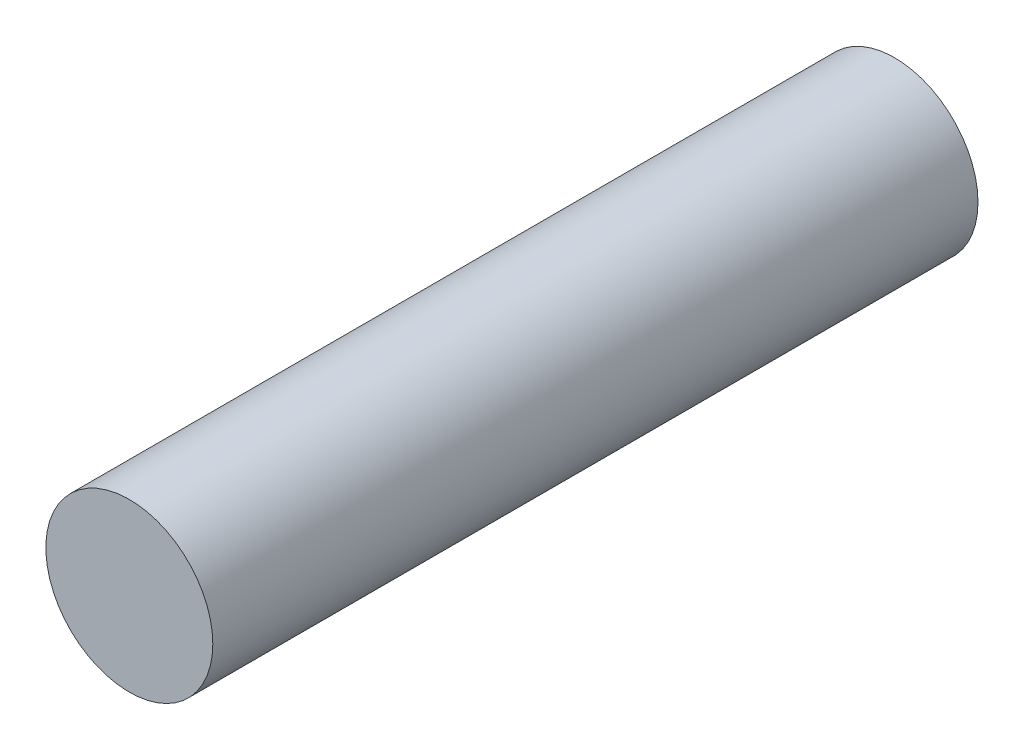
SolidWorks part; units mm, degrees
ref_plane "Płaszczyzna przednia" through (0, 0, 0) normal (0, 0, 1) x (1, 0, 0)
ref_plane "Płaszczyzna górna" through (0, 0, 0) normal (0, 1, 0) x (1, 0, 0)
ref_plane "Płaszczyzna prawa" through (0, 0, 0) normal (1, 0, 0) x (0, 0, -1)
sketch "Szkic1" plane through (0, 0, 0) normal (0, 0, 1) x (1, 0, 0)
  circle A0 centre (0, 0) radius 6
  dimension "D1" = 12
extrude "Dodanie-wyciągnięcie1" add sketch "Szkic1" along normal blind 55
